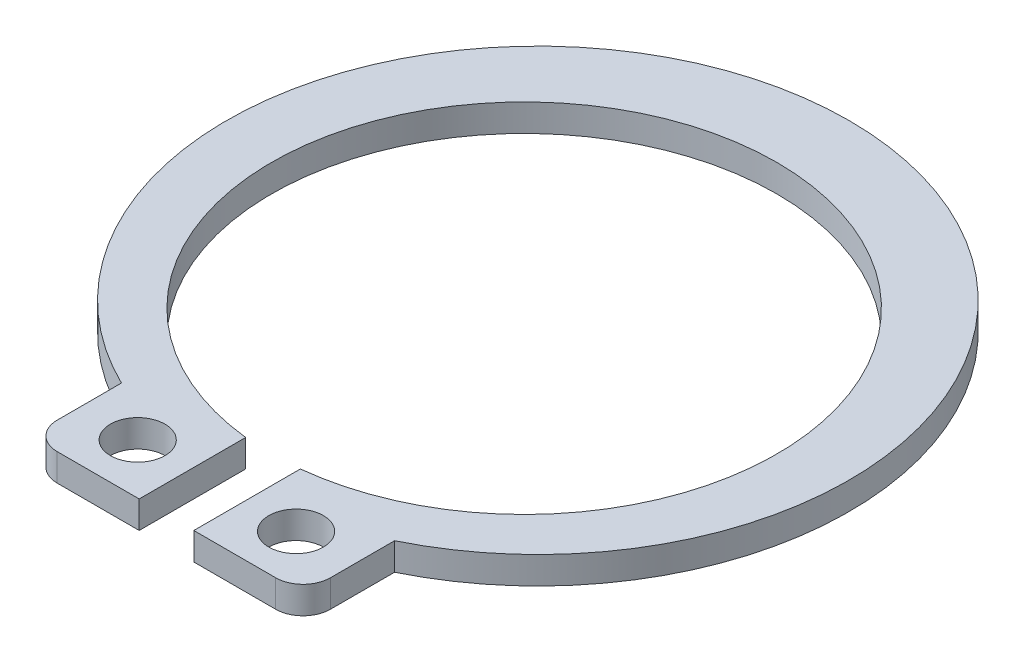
SolidWorks part; units mm, degrees
ref_plane "前基準面" through (0, 0, 0) normal (0, 0, 1) x (1, 0, 0)
ref_plane "上基準面" through (0, 0, 0) normal (0, 1, 0) x (1, 0, 0)
ref_plane "右基準面" through (0, 0, 0) normal (1, 0, 0) x (0, 0, -1)
sketch "草圖2" plane through (0, 0, 0) normal (0, 1, 0) x (1, 0, 0)
  line L0 (-69.2922, 0) -> (61.6336, 0) construction
  line L1 (0, 61.6336) -> (0, -68.9275) construction
  line L2 (-2.981, -11.25) -> (2.9772, -11.25) construction
  line L3 (1, -13.0958) -> (4, -13.0958)
  line L4 (-5, -9.745) -> (-5, -12.0958)
  line L5 (-4, -13.0958) -> (-1, -13.0958)
  line L6 (5, -9.745) -> (5, -12.0958)
  line L7 (-1, -9.1958) -> (-1, -13.0958)
  line L8 (1, -9.1958) -> (1, -13.0958)
  arc A0 (1, -9.1958) -> (-1, -9.1958) centre (0, 0) ccw
  arc A1 (5, -9.745) -> (-5, -9.745) centre (0, 0.5) ccw
  circle A2 centre (-2.9, -11.25) radius 1
  circle A3 centre (2.9, -11.25) radius 1
  arc A4 (-5, -12.0958) -> (-4, -13.0958) centre (-4, -12.0958) ccw
  arc A5 (4, -13.0958) -> (5, -12.0958) centre (4, -12.0958) ccw
  dimension "D1" = 18.5
  dimension "D2" = 22.8
  dimension "D3" = 0.5
  dimension "D4" = 2
  dimension "D10" = 1
  dimension "D5" = 10
  dimension "D6" = 11.25
  dimension "D7" = 2
  dimension "D8" = 1.9
  dimension "D9" = 3.9
extrude "伸長1" add sketch "草圖2" along normal blind 1
